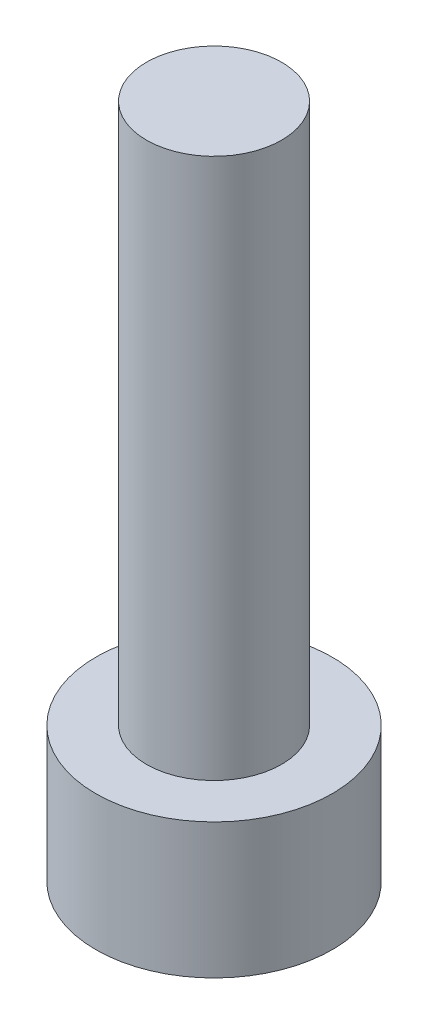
SolidWorks part; units mm, degrees
ref_plane "前视基准面" through (0, 0, 0) normal (0, 0, 1) x (1, 0, 0)
ref_plane "上视基准面" through (0, 0, 0) normal (0, 1, 0) x (1, 0, 0)
ref_plane "右视基准面" through (0, 0, 0) normal (1, 0, 0) x (0, 0, -1)
other "Configuration Table"
sketch "草图1" plane through (0, 0, 0) normal (0, 1, 0) x (1, 0, 0)
  circle A0 centre (0, 0) radius 3.5
  dimension "D1" = 7
extrude "凸台-拉伸1" add sketch "草图1" along normal blind 4
sketch "草图2" plane through (0, 4, 0) normal (0, 1, 0) x (1, 0, 0)
  circle A0 centre (0, 0) radius 2
  dimension "D1" = 4
extrude "凸台-拉伸2" add sketch "草图2" along normal blind 16
sketch "草图3" plane through (0, 0, 0) normal (0, -1, 0) x (1, 0, 0)
  line L1 (1.0587, -1.3708) -> (1.7165, 0.2314)
  line L2 (1.7165, 0.2314) -> (0.6579, 1.6023)
  line L3 (0.6579, 1.6023) -> (-1.0587, 1.3708)
  line L4 (-1.0587, 1.3708) -> (-1.7165, -0.2314)
  line L5 (-1.7165, -0.2314) -> (-0.6579, -1.6023)
  line L6 (-0.6579, -1.6023) -> (1.0587, -1.3708)
  circle A0 centre (0, 0) radius 1.5 construction
  dimension "D1" = 3
extrude "切除-拉伸1" cut sketch "草图3" against normal blind 2
